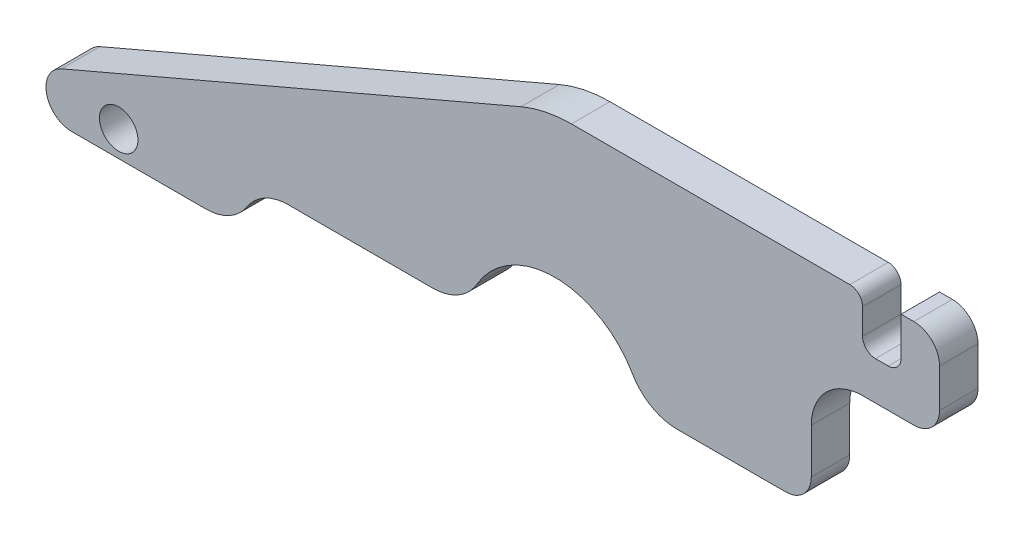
SolidWorks part; units mm, degrees
ref_plane "Front Plane" through (0, 0, 0) normal (0, 0, 1) x (1, 0, 0)
ref_plane "Top Plane" through (0, 0, 0) normal (0, 1, 0) x (1, 0, 0)
ref_plane "Right Plane" through (0, 0, 0) normal (1, 0, 0) x (0, 0, -1)
sketch "Sketch1" plane through (0, 0, 0) normal (0, 0, 1) x (1, 0, 0)
  line L0 (-27.229, 5.4816) -> (-9.3184, 13.1582)
  line L1 (-7.3486, 13.5625) -> (3.5, 13.5625)
  line L2 (4, 13.0625) -> (4, 12.0625)
  line L3 (4.5, 11.5625) -> (5, 11.5625)
  line L4 (5.5, 12.0625) -> (5.5, 13.5625)
  line L5 (5.5, 13.5625) -> (6, 13.5625)
  line L6 (7, 12.5625) -> (7, 11.0625)
  line L7 (6, 10.0625) -> (4.1552, 10.0625)
  line L8 (4.1552, 10.0625) -> (4, 10.0625)
  line L9 (2, 8.0625) -> (2, 6.3125)
  line L13 (-30.9255, 5.3125) -> (8.4484, 5.3125) construction
  line L14 (-26.835, 3.5625) -> (-21.6039, 3.5625)
  line L15 (-12.7631, 5.3125) -> (-18.3961, 5.3125)
  line L16 (-3.2369, 5.3125) -> (1, 5.3125)
  arc A0 (-11.0311, 6.3125) -> (-4.9689, 6.3125) centre (-8, 4.5625) cw
  circle A1 centre (-25, 4.5625) radius 0.75
  arc A2 (2, 6.3125) -> (1, 5.3125) centre (1, 6.3125) cw
  arc A3 (7, 11.0625) -> (6, 10.0625) centre (6, 11.0625) cw
  arc A4 (6, 13.5625) -> (7, 12.5625) centre (6, 12.5625) cw
  arc A5 (-27.229, 5.4816) -> (-26.835, 3.5625) centre (-26.835, 4.5625) ccw
  arc A8 (3.5, 13.5625) -> (4, 13.0625) centre (3.5, 13.0625) cw
  arc A9 (5, 11.5625) -> (5.5, 12.0625) centre (5, 12.0625) ccw
  arc A10 (4, 12.0625) -> (4.5, 11.5625) centre (4.5, 12.0625) ccw
  arc A11 (-9.3184, 13.1582) -> (-7.3486, 13.5625) centre (-7.3486, 8.5625) cw
  arc A12 (4, 10.0625) -> (2, 8.0625) centre (4, 8.0625) ccw
  arc A13 (-21.6039, 3.5625) -> (-20, 4.4375) centre (-21.6039, 5.47) ccw
  arc A14 (-20, 4.4375) -> (-18.3961, 5.3125) centre (-18.3961, 3.405) cw
  arc A15 (-4.9689, 6.3125) -> (-3.2369, 5.3125) centre (-3.2369, 7.3125) ccw
  arc A16 (-11.0311, 6.3125) -> (-12.7631, 5.3125) centre (-12.7631, 7.3125) cw
  point P20 (7, 10.0625)
  point P23 (7, 13.5625)
  point P26 (-30, 3.5625)
  point P27 (0, 0)
  point P29 (-18.7226, 4.3383)
  point P30 (0, 0)
  point P36 (5.5, 11.5625)
  point P41 (-8.375, 13.5625)
  dimension "D6" = 3.5
  dimension "D9" = 5
  dimension "D7" = 1
  dimension "D14" = 2
  dimension "D15" = 5
  dimension "D16" = 2
  dimension "D17" = 0.5
  dimension "D18" = 1.5
  dimension "D13" = 1.9075
  dimension "D1" = 1.5
  dimension "D2" = 3.5
  dimension "D3" = 15.375
  dimension "D4" = 1.5
  dimension "D5" = 2
  dimension "D8" = 10
  dimension "D10" = 1
  dimension "D11" = 5
  dimension "D12" = 17
  dimension "D19" = 5
  dimension "D20" = 32
extrude "Boss-Extrude1" add sketch "Sketch1" along normal blind 1.5
